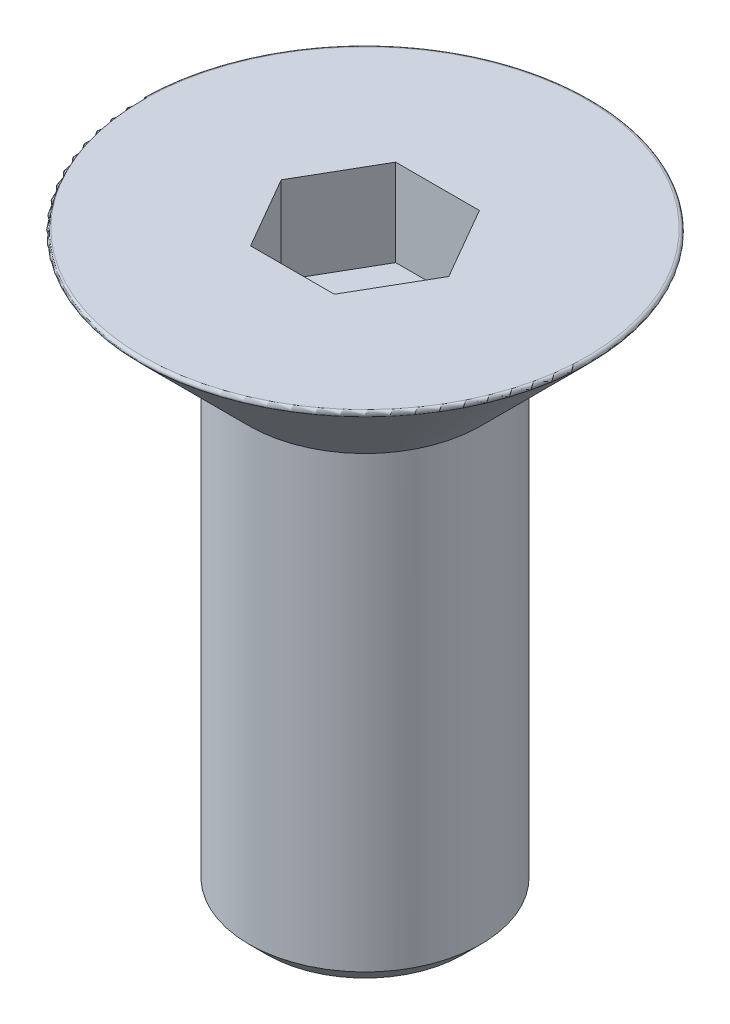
SolidWorks part; units mm, degrees
ref_plane "Plan1" through (0, 0, 0) normal (0, 0, 1) x (1, 0, 0)
ref_plane "Plan2" through (0, 0, 0) normal (0, 1, 0) x (1, 0, 0)
ref_plane "Plan3" through (0, 0, 0) normal (1, 0, 0) x (0, 0, -1)
sketch "Esquisse1" plane through (0, 0, 0) normal (0, 0, 1) x (1, 0, 0)
  line L0 (0, 18.0203) -> (0, -28.5165) construction
  line L1 (0, 0) -> (7.9, 0)
  line L2 (7.9, 0) -> (4, -3.9)
  line L3 (4, -3.9) -> (4, -20)
  line L4 (4, -20) -> (0, -20)
  line L5 (0, -20) -> (0, 0)
  dimension "D1" = 45
  dimension "D2" = 8
  dimension "D3" = 15.8
  dimension "D4" = 20
revolve "Base-Révolution" add sketch "Esquisse1" angle 360 about L0
sketch "Esquisse2" plane through (-0.4184, 0, 2.0942) normal (0, 1, 0) x (-1, 0, 0)
  line L0 (-0.4184, 1.6188) -> (-0.4184, -8.304) construction
  line L1 (-4.7126, -2.0942) -> (5.8794, -2.0942) construction
  line L2 (1.025, 0.4058) -> (2.4683, -2.0942)
  line L3 (1.025, 0.4058) -> (-1.8618, 0.4058)
  line L4 (-1.8618, 0.4058) -> (-3.3052, -2.0942)
  line L5 (1.025, -4.5942) -> (2.4683, -2.0942)
  line L6 (-1.8618, -4.5942) -> (-3.3052, -2.0942)
  line L7 (1.025, -4.5942) -> (-1.8618, -4.5942)
  circle A0 centre (-0.4184, -2.0942) radius 2.8868 construction
  point P13 (-0.4184, 0.4058)
  dimension "D1" = 5
extrude "Enlèv. mat.-Extru.1" cut sketch "Esquisse2" against normal blind 3
chamfer "Chanfrein1" distance 0.625 angle 45
fillet "Congé1" radius 0.1
